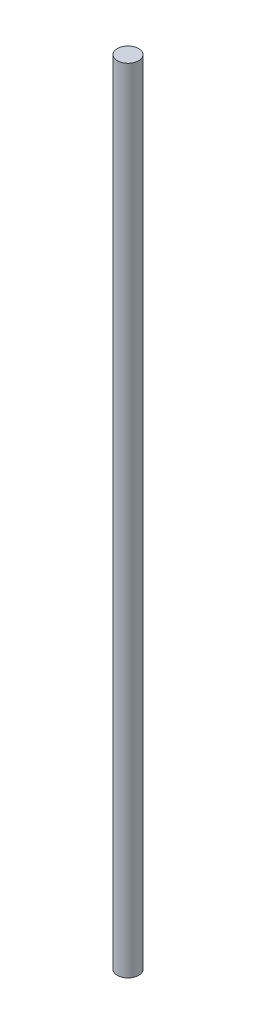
SolidWorks part; units mm, degrees
ref_plane "Piano frontale" through (0, 0, 0) normal (0, 0, 1) x (1, 0, 0)
ref_plane "Piano superiore" through (0, 0, 0) normal (0, 1, 0) x (1, 0, 0)
ref_plane "Piano destro" through (0, 0, 0) normal (1, 0, 0) x (0, 0, -1)
sketch "Sketch1" plane through (0, 0, 0) normal (0, 1, 0) x (1, 0, 0)
  circle A0 centre (0, 0) radius 4
  dimension "D1" = 8
extrude "Boss-Extrude1" add sketch "Sketch1" along normal blind 305
extrude "Cut-Extrude1" cut sketch "Sketch2" against normal blind 6
sketch "Sketch2" plane through (-24.0105, 0, 31.7734) normal (0, -1, 0) x (0.9918, 0, 0.128)
  circle A0 centre (19.7453, -34.5858) radius 4
